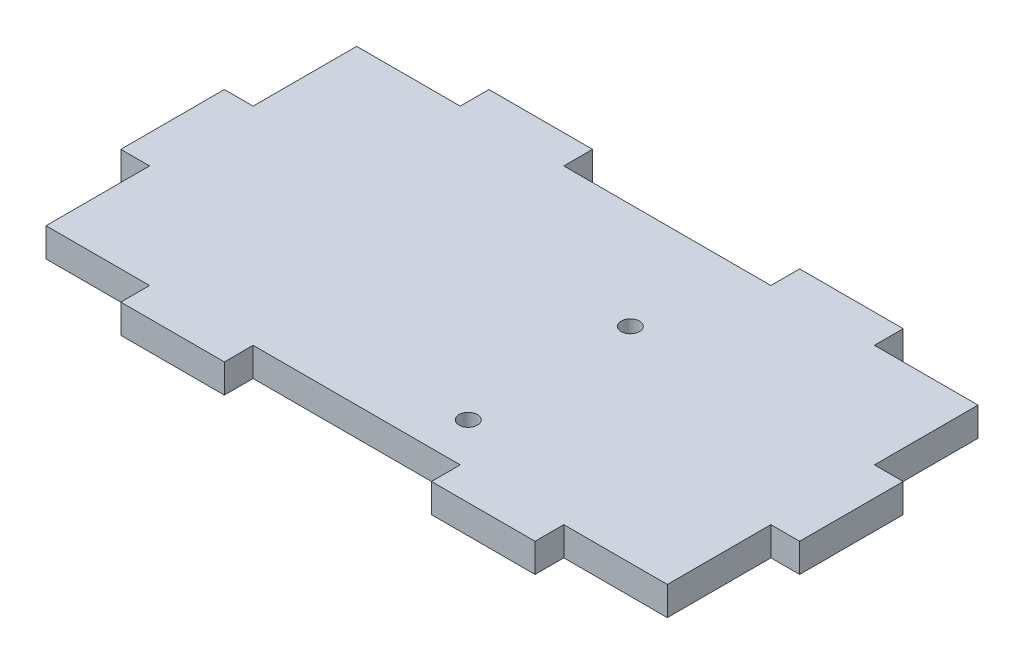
SolidWorks part; units mm, degrees
ref_plane "Plan de face" through (0, 0, 0) normal (0, 0, 1) x (1, 0, 0)
ref_plane "Plan de dessus" through (0, 0, 0) normal (0, 1, 0) x (1, 0, 0)
ref_plane "Plan de droite" through (0, 0, 0) normal (1, 0, 0) x (0, 0, -1)
sketch "Esquisse1" plane through (0, 0, 0) normal (0, 1, 0) x (1, 0, 0)
  line L1 (-54, 27) -> (54, 27)
  line L2 (-54, 27) -> (-54, -27)
  line L3 (-54, -27) -> (54, -27)
  line L4 (54, 27) -> (54, -27)
  line L5 (-54, 27) -> (54, -27) construction
  line L6 (-54, -27) -> (54, 27) construction
  point P0 (0, 0)
  dimension "D1" = 108
  dimension "D2" = 54
extrude "Boss.-Extru.1" add sketch "Esquisse1" along normal blind 5
sketch "Esquisse2" plane through (0, 5, 0) normal (0, 1, 0) x (1, 0, 0)
  line L0 (-54, 27) -> (-36, 27) construction
  line L1 (-36, 27) -> (-18, 27) construction
  line L2 (54, 27) -> (-54, 27) construction
  line L3 (-18, 27) -> (0, 27) construction
  line L4 (0, 27) -> (18, 27) construction
  line L5 (18, 27) -> (36, 27) construction
  line L6 (36, 27) -> (54, 27) construction
  line L7 (-54, 27) -> (-54, 9) construction
  line L8 (-36, 27) -> (-18, 27)
  line L9 (-36, 27) -> (-36, 32)
  line L10 (-36, 32) -> (-18, 32)
  line L11 (-18, 27) -> (-18, 32)
  line L16 (-54, 9) -> (-54, -9) construction
  line L17 (-54, -9) -> (-54, -27) construction
  line L18 (-54, 27) -> (-54, -27) construction
  line L20 (-54, 9) -> (-59, 9)
  line L21 (-54, 9) -> (-54, 0)
  line L22 (-54, 0) -> (-59, 0)
  line L23 (-59, 9) -> (-59, 0)
  dimension "D1" = 5
extrude "Boss.-Extru.2" add sketch "Esquisse2" against normal up to surface (5 mm away)
ref_plane "Plan1" through (0, 0, 0) normal (-1, 0, 0) x (0, 0, 1)
ref_plane "Plan2" through (0, 0, 0) normal (0, 0, -1) x (-1, 0, 0)
mirror "Symétrie1" about plane through (0, 0, 0) normal (-1, 0, 0) of "Boss.-Extru.2"
mirror "Symétrie2" about plane through (0, 0, 0) normal (0, 0, -1) of "Symétrie1", "Boss.-Extru.2"
extrude "Enlèv. mat.-Extru.1" cut sketch "Esquisse3" against normal blind 10
sketch "Esquisse3" plane through (-46.1395, 5, -68.1635) normal (0, 1, 0) x (1, 0, 0)
  circle A0 centre (58.0705, -59.5181) radius 1.5886
  circle A1 centre (58.0591, -87.6847) radius 1.6
